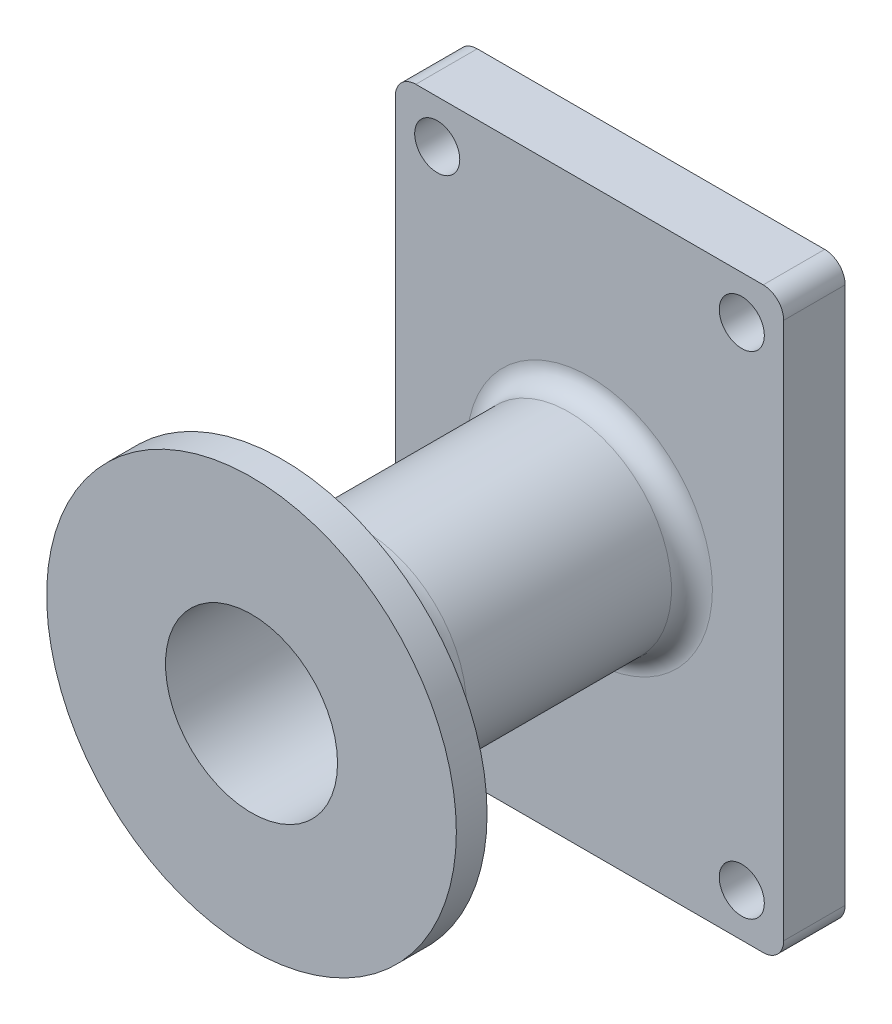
SolidWorks part; units mm, degrees
ref_plane "Front Plane" through (0, 0, 0) normal (0, 0, 1) x (1, 0, 0)
ref_plane "Top Plane" through (0, 0, 0) normal (0, 1, 0) x (1, 0, 0)
ref_plane "Right Plane" through (0, 0, 0) normal (1, 0, 0) x (0, 0, -1)
sketch "Sketch1" plane through (0, 0, 0) normal (0, 0, 1) x (1, 0, 0)
  line L1 (-235.8221, -297.1442) -> (-218.8622, -297.1442)
  line L2 (-236.8221, -296.1442) -> (-236.8221, -269.9131)
  line L3 (-235.8221, -268.9131) -> (-218.8622, -268.9131)
  line L4 (-217.8622, -296.1442) -> (-217.8622, -269.9131)
  line L5 (-236.8221, -297.1442) -> (-217.8622, -268.9131) construction
  line L6 (-236.8221, -268.9131) -> (-217.8622, -297.1442) construction
  circle A0 centre (-219.9084, -271.0287) radius 1.1
  circle A1 centre (-219.9084, -295.0287) radius 1.1
  circle A2 centre (-234.7759, -295.0287) radius 1.1
  circle A3 centre (-234.7759, -271.0287) radius 1.1
  arc A4 (-217.8622, -296.1442) -> (-218.8622, -297.1442) centre (-218.8622, -296.1442) cw
  arc A5 (-235.8221, -297.1442) -> (-236.8221, -296.1442) centre (-235.8221, -296.1442) cw
  arc A6 (-236.8221, -269.9131) -> (-235.8221, -268.9131) centre (-235.8221, -269.9131) cw
  arc A7 (-217.8622, -269.9131) -> (-218.8622, -268.9131) centre (-218.8622, -269.9131) ccw
  circle A8 centre (-227.3422, -283.0287) radius 4.2
  point P8 (-227.3422, -283.0287)
  dimension "D1" = 1
extrude "Boss-Extrude1" add sketch "Sketch1" along normal blind 3
sketch "Sketch2" plane through (0, 0, 3) normal (0, 0, 1) x (1, 0, 0)
  circle A0 centre (-227.3422, -283.0287) radius 4.2
  circle A1 centre (-227.3422, -283.0287) radius 5
extrude "Boss-Extrude2" add sketch "Sketch2" along normal blind 15
sketch "Sketch3" plane through (0, 0, 18) normal (0, 0, 1) x (1, 0, 0)
  circle A0 centre (-227.3422, -283.0287) radius 4.2
  circle A1 centre (-227.3422, -283.0287) radius 7
extrude "Boss-Extrude3" add sketch "Sketch3" along normal blind 1.5
sketch "Sketch5" plane through (0, 0, 19.5) normal (0, 0, 1) x (1, 0, 0)
  circle A0 centre (-227.3422, -283.0287) radius 4.2
  circle A1 centre (-227.3422, -283.0287) radius 10
extrude "Boss-Extrude4" add sketch "Sketch5" against normal blind 1.5
fillet "Fillet2" radius 4 1 edges at (-222.3422, -283.0287, 18)
fillet "Fillet3" radius 1 1 edges at (-232.3422, -283.0287, 3)
